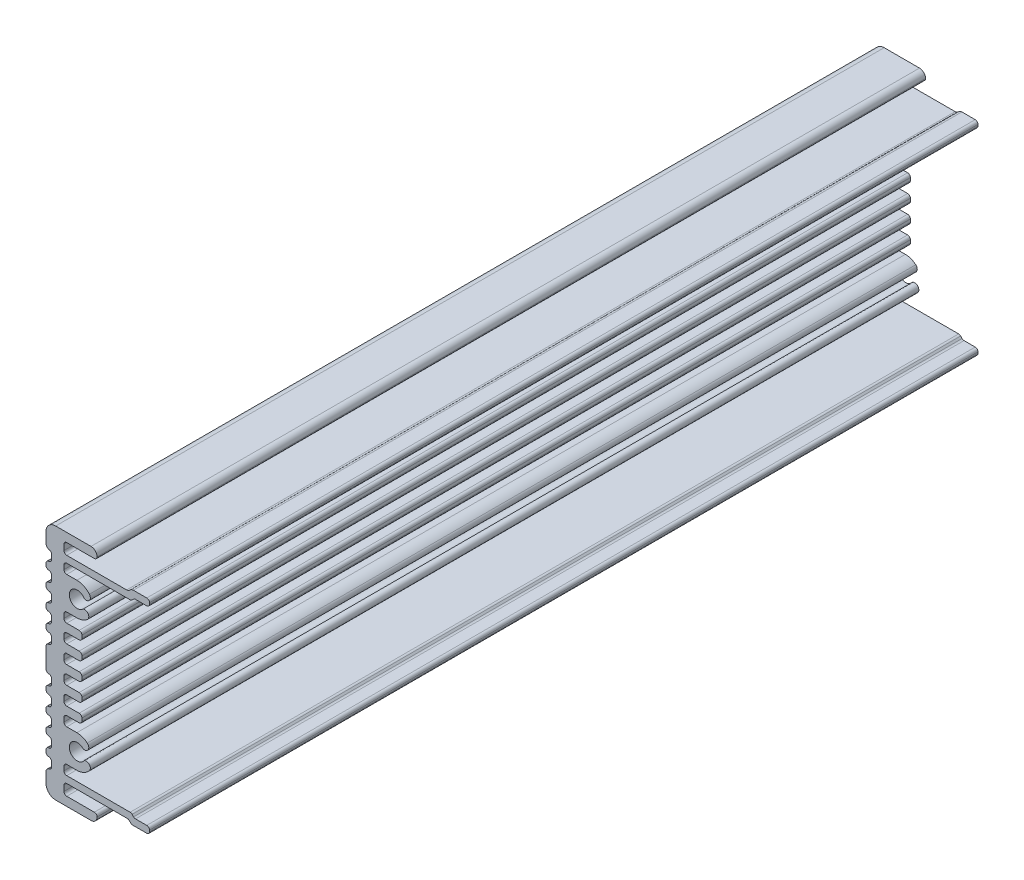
SolidWorks part; units mm, degrees
ref_plane "Front Plane" through (0, 0, 0) normal (0, 0, 1) x (1, 0, 0)
ref_plane "Top Plane" through (0, 0, 0) normal (0, 1, 0) x (1, 0, 0)
ref_plane "Right Plane" through (0, 0, 0) normal (1, 0, 0) x (0, 0, -1)
sketch "Model" plane through (0, 0, 0) normal (0, 0, 1) x (1, 0, 0)
  line L0 (1.016, -16.954) -> (1.016, -16.0692)
  line L1 (0.5741, -15.5655) -> (0.4419, -15.5482)
  line L2 (0.4419, -14.1698) -> (0.5741, -14.1525)
  line L3 (1.016, -13.6488) -> (1.016, -12.7672)
  line L4 (0.5741, -12.2635) -> (0.4419, -12.2462)
  line L5 (0.4419, -10.8678) -> (0.5741, -10.8505)
  line L6 (1.016, -10.3468) -> (1.016, -9.4652)
  line L7 (0.5741, -8.9615) -> (0.4419, -8.9442)
  line L8 (0.4419, -7.5658) -> (0.5741, -7.5485)
  line L9 (1.016, -7.0448) -> (1.016, -6.1632)
  line L10 (0.5741, -5.6595) -> (0.4419, -5.6422)
  line L11 (0.4419, -4.2638) -> (0.5741, -4.2465)
  line L12 (1.016, -3.7428) -> (1.016, -2.8612)
  line L13 (0.5741, -2.3575) -> (0.4419, -2.3402)
  line L14 (0.4419, 2.3402) -> (0.5741, 2.3575)
  line L15 (1.016, 2.8612) -> (1.016, 3.7428)
  line L16 (0.5741, 4.2465) -> (0.4419, 4.2638)
  line L17 (0.4419, 5.6422) -> (0.5741, 5.6595)
  line L18 (1.016, 6.1632) -> (1.016, 7.0448)
  line L19 (0.5741, 7.5485) -> (0.4419, 7.5658)
  line L20 (0.4419, 8.9442) -> (0.5741, 8.9615)
  line L21 (1.016, 9.4652) -> (1.016, 10.3468)
  line L22 (0.5741, 10.8505) -> (0.4419, 10.8678)
  line L23 (0.4419, 12.2462) -> (0.5741, 12.2635)
  line L24 (1.016, 12.7672) -> (1.016, 13.6488)
  line L25 (0.5741, 14.1525) -> (0.4419, 14.1698)
  line L26 (0.4419, 15.5482) -> (0.5741, 15.5655)
  line L27 (1.016, 16.0692) -> (1.016, 16.954)
  line L28 (8.89, 20.2082) -> (3.81, 20.2082)
  line L29 (3.302, 19.7002) -> (3.302, 18.6842)
  line L30 (3.81, 18.1762) -> (14.8342, 18.1762)
  line L31 (15.409, 18.4143) -> (15.5023, 18.5076)
  line L32 (16.0771, 18.7457) -> (18.5344, 18.7457)
  line L33 (18.5344, 17.4885) -> (16.4716, 17.4885)
  line L34 (16.1123, 17.3397) -> (15.8405, 17.0678)
  line L35 (15.4813, 16.919) -> (3.81, 16.919)
  line L36 (3.302, 16.411) -> (3.302, 15.649)
  line L37 (3.81, 15.141) -> (5.678, 15.141)
  line L38 (3.81, 9.1466) -> (5.678, 9.1466)
  line L39 (3.302, 8.6386) -> (3.302, 7.8765)
  line L40 (3.81, 7.3685) -> (6.096, 7.3685)
  line L41 (6.604, 6.8605) -> (6.604, 6.3525)
  line L42 (6.096, 5.8445) -> (3.81, 5.8445)
  line L43 (3.302, 5.3365) -> (3.302, 4.5745)
  line L44 (3.81, 4.0665) -> (6.096, 4.0665)
  line L45 (6.604, 3.5585) -> (6.604, 3.0505)
  line L46 (6.096, 2.5425) -> (3.81, 2.5425)
  line L47 (3.302, 2.0345) -> (3.302, 1.2725)
  line L48 (3.81, 0.7645) -> (6.096, 0.7645)
  line L49 (6.604, 0.2565) -> (6.604, -0.2515)
  line L50 (6.096, -0.7595) -> (3.81, -0.7595)
  line L51 (3.302, -1.2675) -> (3.302, -2.0295)
  line L52 (3.81, -2.5375) -> (6.096, -2.5375)
  line L53 (6.604, -3.0455) -> (6.604, -3.5535)
  line L54 (6.096, -4.0615) -> (3.81, -4.0615)
  line L55 (3.302, -4.5695) -> (3.302, -5.3315)
  line L56 (3.81, -5.8395) -> (6.096, -5.8395)
  line L57 (6.604, -6.3475) -> (6.604, -6.8555)
  line L58 (6.096, -7.3635) -> (3.81, -7.3635)
  line L59 (3.302, -7.8715) -> (3.302, -8.6336)
  line L60 (5.678, -9.1416) -> (3.81, -9.1416)
  line L61 (5.678, -15.136) -> (3.81, -15.136)
  line L62 (3.302, -15.644) -> (3.302, -16.406)
  line L63 (3.81, -16.914) -> (15.4813, -16.914)
  line L64 (15.8405, -17.0628) -> (16.1123, -17.3347)
  line L65 (16.4716, -17.4835) -> (18.5344, -17.4835)
  line L66 (18.5344, -18.7407) -> (15.9508, -18.7407)
  line L67 (15.5916, -18.5919) -> (15.3197, -18.32)
  line L68 (14.9605, -18.1712) -> (3.81, -18.1712)
  line L69 (3.302, -18.6792) -> (3.302, -19.6952)
  line L70 (3.81, -20.2032) -> (8.89, -20.2032)
  line L71 (0, -20.0508) -> (0, -18.1984)
  line L72 (8.2804, 21.8338) -> (1.778, 21.8338)
  line L73 (19.0424, -18.2327) -> (19.0424, -17.9915)
  line L74 (1.778, -21.8288) -> (8.2804, -21.8288)
  line L75 (19.0424, 17.9965) -> (19.0424, 18.2377)
  line L76 (0, 8.0695) -> (0, 8.4405)
  line L77 (0, 4.7675) -> (0, 5.1385)
  line L78 (0, -1.8365) -> (0, 1.8365)
  line L79 (0, -5.1385) -> (0, -4.7675)
  line L80 (0, -8.4405) -> (0, -8.0695)
  line L81 (0, -11.7425) -> (0, -11.3715)
  line L82 (0, -15.0445) -> (0, -14.6735)
  line L83 (0, 11.3715) -> (0, 11.7425)
  line L84 (0, 14.6735) -> (0, 15.0445)
  line L85 (0, 18.1984) -> (0, 20.0558)
  arc A0 (7.9823, 14.0605) -> (5.678, 15.141) centre (5.678, 12.1438) ccw
  arc A1 (6.8106, 13.0859) -> (7.9823, 14.0605) centre (7.3965, 13.5732) ccw
  arc A2 (6.8106, 13.0859) -> (6.6201, 11.0112) centre (5.678, 12.1438) ccw
  arc A3 (7.5947, 9.8396) -> (6.6201, 11.0112) centre (7.1074, 10.4254) ccw
  arc A4 (5.678, 9.1466) -> (7.5947, 9.8396) centre (5.678, 12.1438) ccw
  arc A5 (7.5947, -9.8346) -> (5.678, -9.1416) centre (5.678, -12.1388) ccw
  arc A6 (6.6201, -11.0062) -> (7.5947, -9.8346) centre (7.1074, -10.4204) ccw
  arc A7 (6.6201, -11.0062) -> (6.8106, -13.0809) centre (5.678, -12.1388) ccw
  arc A8 (7.9823, -14.0555) -> (6.8106, -13.0809) centre (7.3965, -13.5682) ccw
  arc A9 (5.678, -15.136) -> (7.9823, -14.0555) centre (5.678, -12.1388) ccw
  arc A10 (6.604, 6.8605) -> (6.096, 7.3685) centre (6.096, 6.8605) ccw
  arc A11 (6.604, 3.5585) -> (6.096, 4.0665) centre (6.096, 3.5585) ccw
  arc A12 (3.302, 4.5745) -> (3.81, 4.0665) centre (3.81, 4.5745) ccw
  arc A13 (3.302, 1.2725) -> (3.81, 0.7645) centre (3.81, 1.2725) ccw
  arc A14 (6.604, 0.2565) -> (6.096, 0.7645) centre (6.096, 0.2565) ccw
  arc A15 (3.302, -2.0295) -> (3.81, -2.5375) centre (3.81, -2.0295) ccw
  arc A16 (6.604, -3.0455) -> (6.096, -2.5375) centre (6.096, -3.0455) ccw
  arc A17 (3.302, -5.3315) -> (3.81, -5.8395) centre (3.81, -5.3315) ccw
  arc A18 (6.604, -6.3475) -> (6.096, -5.8395) centre (6.096, -6.3475) ccw
  arc A19 (3.81, -4.0615) -> (3.302, -4.5695) centre (3.81, -4.5695) ccw
  arc A20 (6.096, -4.0615) -> (6.604, -3.5535) centre (6.096, -3.5535) ccw
  arc A21 (3.81, -0.7595) -> (3.302, -1.2675) centre (3.81, -1.2675) ccw
  arc A22 (6.096, -0.7595) -> (6.604, -0.2515) centre (6.096, -0.2515) ccw
  arc A23 (3.81, 2.5425) -> (3.302, 2.0345) centre (3.81, 2.0345) ccw
  arc A24 (6.096, 2.5425) -> (6.604, 3.0505) centre (6.096, 3.0505) ccw
  arc A25 (3.81, 5.8445) -> (3.302, 5.3365) centre (3.81, 5.3365) ccw
  arc A26 (6.096, 5.8445) -> (6.604, 6.3525) centre (6.096, 6.3525) ccw
  arc A27 (1.778, 21.8338) -> (0, 20.0558) centre (1.778, 20.0558) ccw
  arc A28 (0, -20.0508) -> (1.778, -21.8288) centre (1.778, -20.0508) ccw
  arc A29 (16.0771, 18.7457) -> (15.5023, 18.5076) centre (16.0771, 17.9329) ccw
  arc A30 (14.8342, 18.1762) -> (15.409, 18.4143) centre (14.8342, 18.989) ccw
  arc A31 (0.6096, -17.4518) -> (0, -18.1984) centre (0.762, -18.1984) ccw
  arc A32 (1.016, -16.0692) -> (0.5741, -15.5655) centre (0.508, -16.0692) ccw
  arc A33 (0, -15.0445) -> (0.4419, -15.5482) centre (0.508, -15.0445) ccw
  arc A34 (0.4419, -14.1698) -> (0, -14.6735) centre (0.508, -14.6735) ccw
  arc A35 (0.5741, -14.1525) -> (1.016, -13.6488) centre (0.508, -13.6488) ccw
  arc A36 (1.016, -12.7672) -> (0.5741, -12.2635) centre (0.508, -12.7672) ccw
  arc A37 (0, -11.7425) -> (0.4419, -12.2462) centre (0.508, -11.7425) ccw
  arc A38 (3.302, 7.8765) -> (3.81, 7.3685) centre (3.81, 7.8765) ccw
  arc A39 (3.81, 9.1466) -> (3.302, 8.6386) centre (3.81, 8.6386) ccw
  arc A40 (3.81, -9.1416) -> (3.302, -8.6336) centre (3.81, -8.6336) cw
  arc A41 (3.81, -7.3635) -> (3.302, -7.8715) centre (3.81, -7.8715) ccw
  arc A42 (6.096, -7.3635) -> (6.604, -6.8555) centre (6.096, -6.8555) ccw
  arc A43 (0.4419, -10.8678) -> (0, -11.3715) centre (0.508, -11.3715) ccw
  arc A44 (0.5741, -10.8505) -> (1.016, -10.3468) centre (0.508, -10.3468) ccw
  arc A45 (0.4419, -7.5658) -> (0, -8.0695) centre (0.508, -8.0695) ccw
  arc A46 (0, -8.4405) -> (0.4419, -8.9442) centre (0.508, -8.4405) ccw
  arc A47 (1.016, -9.4652) -> (0.5741, -8.9615) centre (0.508, -9.4652) ccw
  arc A48 (1.016, -6.1632) -> (0.5741, -5.6595) centre (0.508, -6.1632) ccw
  arc A49 (0, -5.1385) -> (0.4419, -5.6422) centre (0.508, -5.1385) ccw
  arc A50 (1.016, -2.8612) -> (0.5741, -2.3575) centre (0.508, -2.8612) ccw
  arc A51 (0, -1.8365) -> (0.4419, -2.3402) centre (0.508, -1.8365) ccw
  arc A52 (1.016, 3.7428) -> (0.5741, 4.2465) centre (0.508, 3.7428) ccw
  arc A53 (0, 4.7675) -> (0.4419, 4.2638) centre (0.508, 4.7675) ccw
  arc A54 (0, 8.0695) -> (0.4419, 7.5658) centre (0.508, 8.0695) ccw
  arc A55 (1.016, 10.3468) -> (0.5741, 10.8505) centre (0.508, 10.3468) ccw
  arc A56 (0, 11.3715) -> (0.4419, 10.8678) centre (0.508, 11.3715) ccw
  arc A57 (0, 14.6735) -> (0.4419, 14.1698) centre (0.508, 14.6735) ccw
  arc A58 (0, 18.1984) -> (0.6096, 17.4518) centre (0.762, 18.1984) ccw
  arc A59 (0.5741, 15.5655) -> (1.016, 16.0692) centre (0.508, 16.0692) ccw
  arc A60 (0.4419, 15.5482) -> (0, 15.0445) centre (0.508, 15.0445) ccw
  arc A61 (0.5741, 12.2635) -> (1.016, 12.7672) centre (0.508, 12.7672) ccw
  arc A62 (0.5741, 8.9615) -> (1.016, 9.4652) centre (0.508, 9.4652) ccw
  arc A63 (0.5741, 5.6595) -> (1.016, 6.1632) centre (0.508, 6.1632) ccw
  arc A64 (0.5741, 2.3575) -> (1.016, 2.8612) centre (0.508, 2.8612) ccw
  arc A65 (0.4419, 2.3402) -> (0, 1.8365) centre (0.508, 1.8365) ccw
  arc A66 (0.4419, 8.9442) -> (0, 8.4405) centre (0.508, 8.4405) ccw
  arc A67 (0.4419, 12.2462) -> (0, 11.7425) centre (0.508, 11.7425) ccw
  arc A68 (0.4419, 5.6422) -> (0, 5.1385) centre (0.508, 5.1385) ccw
  arc A69 (0.5741, -4.2465) -> (1.016, -3.7428) centre (0.508, -3.7428) ccw
  arc A70 (0.4419, -4.2638) -> (0, -4.7675) centre (0.508, -4.7675) ccw
  arc A71 (0.5741, -7.5485) -> (1.016, -7.0448) centre (0.508, -7.0448) ccw
  arc A72 (1.016, 7.0448) -> (0.5741, 7.5485) centre (0.508, 7.0448) ccw
  arc A73 (1.016, 13.6488) -> (0.5741, 14.1525) centre (0.508, 13.6488) ccw
  arc A74 (8.2804, -21.8288) -> (9.398, -20.7112) centre (8.2804, -20.7112) ccw
  arc A75 (9.398, -20.7112) -> (8.89, -20.2032) centre (8.89, -20.7112) ccw
  arc A76 (3.302, -19.6952) -> (3.81, -20.2032) centre (3.81, -19.6952) ccw
  arc A77 (3.81, -18.1712) -> (3.302, -18.6792) centre (3.81, -18.6792) ccw
  arc A78 (3.81, -15.136) -> (3.302, -15.644) centre (3.81, -15.644) ccw
  arc A79 (3.302, -16.406) -> (3.81, -16.914) centre (3.81, -16.406) ccw
  arc A80 (3.302, 15.649) -> (3.81, 15.141) centre (3.81, 15.649) ccw
  arc A81 (3.81, 16.919) -> (3.302, 16.411) centre (3.81, 16.411) ccw
  arc A82 (18.5344, 17.4885) -> (19.0424, 17.9965) centre (18.5344, 17.9965) ccw
  arc A83 (19.0424, 18.2377) -> (18.5344, 18.7457) centre (18.5344, 18.2377) ccw
  arc A84 (15.4813, 16.919) -> (15.8405, 17.0678) centre (15.4813, 17.427) ccw
  arc A85 (16.4716, 17.4885) -> (16.1123, 17.3397) centre (16.4716, 16.9805) ccw
  arc A86 (15.3197, -18.32) -> (14.9605, -18.1712) centre (14.9605, -18.6792) ccw
  arc A87 (15.5916, -18.5919) -> (15.9508, -18.7407) centre (15.9508, -18.2327) ccw
  arc A88 (18.5344, -18.7407) -> (19.0424, -18.2327) centre (18.5344, -18.2327) ccw
  arc A89 (19.0424, -17.9915) -> (18.5344, -17.4835) centre (18.5344, -17.9915) ccw
  arc A90 (16.1123, -17.3347) -> (16.4716, -17.4835) centre (16.4716, -16.9755) ccw
  arc A91 (15.8405, -17.0628) -> (15.4813, -16.914) centre (15.4813, -17.422) ccw
  arc A92 (8.89, 20.2082) -> (9.398, 20.7162) centre (8.89, 20.7162) ccw
  arc A93 (9.398, 20.7162) -> (8.2804, 21.8338) centre (8.2804, 20.7162) ccw
  arc A94 (1.016, 16.954) -> (0.6096, 17.4518) centre (0.508, 16.954) ccw
  arc A95 (0.6096, -17.4518) -> (1.016, -16.954) centre (0.508, -16.954) ccw
  arc A96 (3.81, 20.2082) -> (3.302, 19.7002) centre (3.81, 19.7002) ccw
  arc A97 (3.302, 18.6842) -> (3.81, 18.1762) centre (3.81, 18.6842) ccw
  dimension "D1" = 0.508
  dimension "D2" = 0.508
extrude "Boss-Extrude1" add sketch "Model" against normal up to surface (152.4 mm away)
sketch "Sketch1" plane through (0, 21.8338, 0) normal (0, 1, 0) x (1, 0, 0)
  line L0 (9.398, 152.4) -> (9.398, 0) construction
  line L2 (-3.9084, 120.3588) -> (36.4153, 80.0351)
  dimension "D1" = 45
extrude "Cut-Extrude1" [suppressed] cut sketch "Sketch1" against normal through all and the other way through all
sketch "Sketch2" plane through (0, 0, 0) normal (0, 0, 1) x (1, 0, 0)
  line L0 (5.678, 12.1438) -> (5.7542, 12.1438) construction
  line L1 (5.678, -12.1388) -> (5.7542, -12.1388) construction
  circle A0 centre (5.7542, 12.1438) radius 1.4732
  circle A1 centre (5.7542, -12.1388) radius 1.4732
  arc A2 (6.6201, -11.0062) -> (6.8106, -13.0809) centre (5.678, -12.1388) ccw construction
  dimension "D1" = 0.0762
extrude "Cut-Extrude2" cut sketch "Sketch2" against normal through all
sketch "Sketch4" plane through (0, 0, 0) normal (0, 0, 1) x (1, 0, 0)
  arc A0 (5.7161, 13.6165) -> (5.7161, 10.6711) centre (5.7542, 12.1438) ccw
  arc A1 (5.7161, 13.6165) -> (5.7161, 10.6711) centre (5.678, 12.1438) ccw construction
  arc A2 (5.7161, 13.6165) -> (5.7161, 10.6711) centre (5.678, 12.1438) ccw
  arc A3 (5.7161, -10.6661) -> (5.7161, -13.6115) centre (5.7542, -12.1388) ccw
  arc A4 (5.7161, -10.6661) -> (5.7161, -13.6115) centre (5.678, -12.1388) ccw
  arc A5 (6.8267, -11.1288) -> (5.7161, -10.6661) centre (5.7542, -12.1388) ccw construction
  arc A6 (5.7161, -13.6115) -> (7.0077, -12.9128) centre (5.7542, -12.1388) ccw construction
  arc A7 (5.7161, -10.6661) -> (5.7161, -13.6115) centre (5.678, -12.1388) ccw construction
  dimension "D1" = 2
extrude "Boss-Extrude2" add sketch "Sketch4" against normal up to vertex (152.4 mm away)
